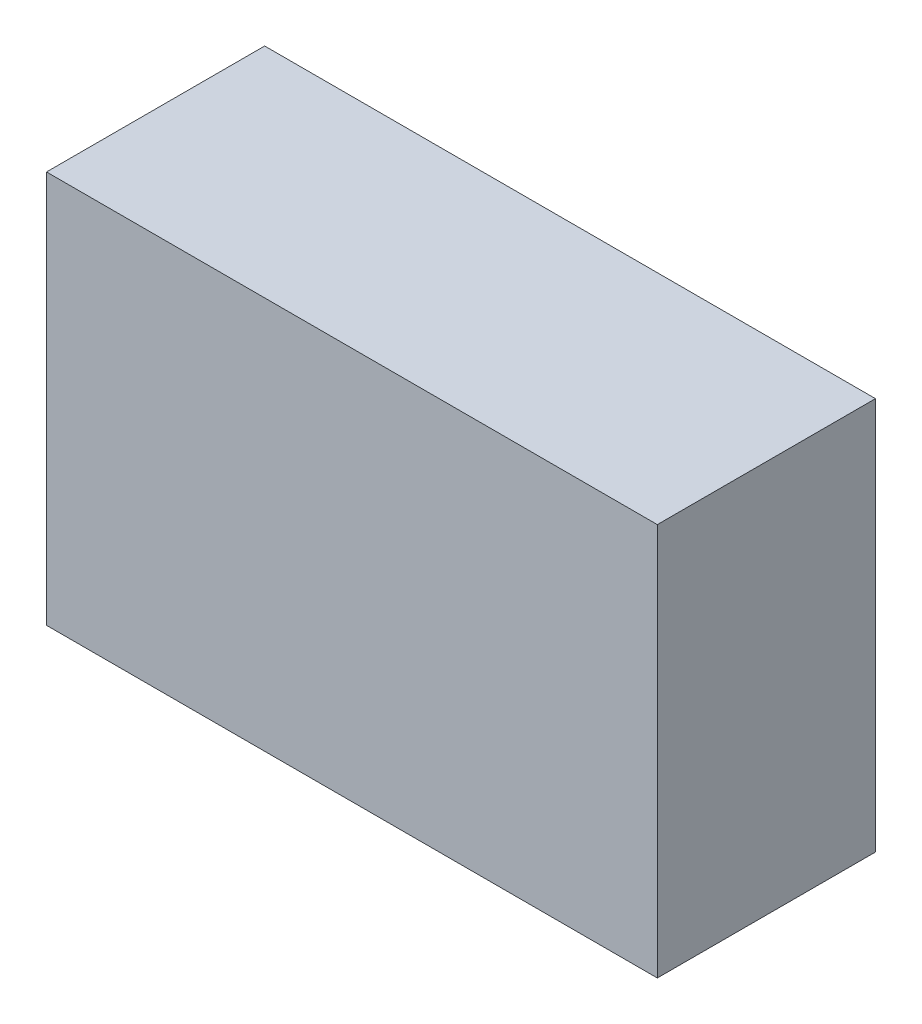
SolidWorks part; units mm, degrees
ref_plane "Face" through (0, 0, 0) normal (0, 0, 1) x (1, 0, 0)
ref_plane "Dessus" through (0, 0, 0) normal (0, 1, 0) x (1, 0, 0)
ref_plane "Droite" through (0, 0, 0) normal (1, 0, 0) x (0, 0, -1)
sketch "Esquisse1" plane through (0, 0, 0) normal (0, 0, 1) x (1, 0, 0)
  line L1 (0, 0) -> (70, 0)
  line L2 (0, 0) -> (0, 45)
  line L3 (0, 45) -> (70, 45)
  line L4 (70, 0) -> (70, 45)
  dimension "D1" = 70
  dimension "D2" = 45
extrude "Extrusion1" add sketch "Esquisse1" along normal blind 25
sketch "Esquisse2"
